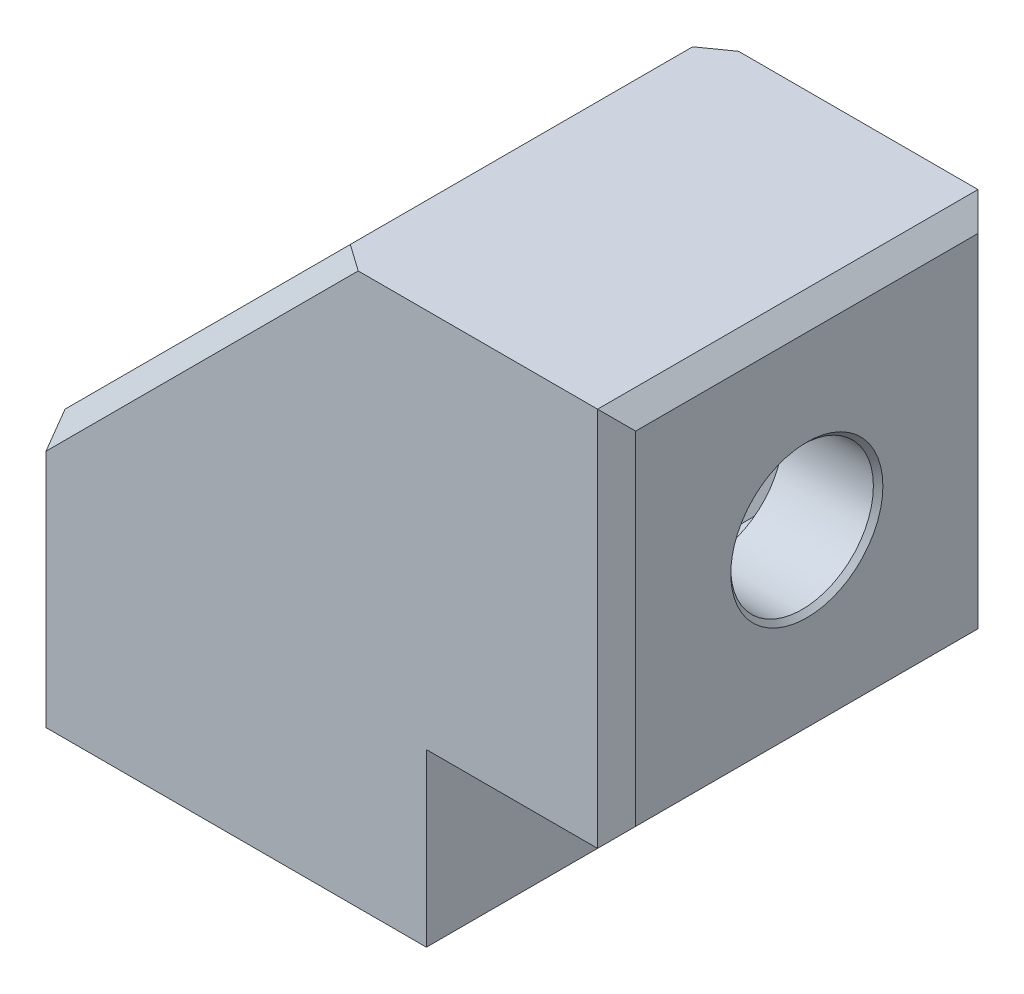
SolidWorks part; units mm, degrees
ref_plane "Front Plane" through (0, 0, 0) normal (0, 0, 1) x (1, 0, 0)
ref_plane "Top Plane" through (0, 0, 0) normal (0, 1, 0) x (1, 0, 0)
ref_plane "Right Plane" through (0, 0, 0) normal (1, 0, 0) x (0, 0, -1)
sketch "Sketch1" plane through (0, 0, 0) normal (0, 0, 1) x (1, 0, 0)
  line L0 (0, 38.1) -> (38.1, 76.2)
  line L1 (0, 0) -> (50.8, 0)
  line L2 (0, 0) -> (0, 38.1)
  line L3 (38.1, 76.2) -> (76.2, 76.2)
  line L4 (76.2, 25.4) -> (76.2, 76.2)
  line L8 (76.2, 25.4) -> (50.8, 25.4)
  line L9 (50.8, 0) -> (50.8, 25.4)
  point P3 (25.4, 0)
  dimension "D1" = 76.2
  dimension "D2" = 25.4
  dimension "D3" = 38.1
  dimension "D4" = 38.1
  dimension "D5" = 25.4
  dimension "D6" = 25.4
extrude "Boss-Extrude1" add sketch "Sketch1" along normal blind 50.8
shell "Shell1" thickness 2.54
sketch "Sketch2" plane through (0, 0, 0) normal (0, -1, 0) x (1, 0, 0)
  line L0 (0, 50.8) -> (0, 0) construction
  line L2 (0, 50.8) -> (50.8, 50.8) construction
  circle A0 centre (25.4, 25.4) radius 9.525
  dimension "D1" = 19.05
  dimension "D2" = 25.4
  dimension "D3" = 25.4
sketch "Sketch3" plane through (76.2, 0, 0) normal (1, 0, 0) x (0, 0, -1)
  line L0 (-50.8, 76.2) -> (0, 76.2) construction
  line L2 (0, 25.4) -> (0, 76.2) construction
  circle A0 centre (-25.4, 50.8) radius 9.525
  dimension "D3" = 19.05
  dimension "D1" = 25.4
  dimension "D2" = 25.4
hole_wizard "3/4 (0.75) Diameter Hole1" positions "Sketch4" profile "Sketch5" hole size "3/4" standard "ANSI Inch"
sketch "Sketch4" plane through (76.2, 0, 0) normal (1, 0, 0) x (0, 0, -1)
  point P0 (-25.4, 50.8)
sketch "Sketch5" plane through (76.2, 50.8, 25.4) normal (0, 1, 0) x (0, 0, -1)
  line L0 (0, 0) -> (0, 12.7)
  line L1 (0, 12.7) -> (9.525, 12.7)
  line L2 (9.525, 12.7) -> (9.525, 0.635)
  line L3 (9.525, 0.635) -> (10.16, 0)
  line L5 (10.16, 0) -> (0, 0)
  line L6 (-9.525, 0.635) -> (-10.16, 0) construction
  line L11 (0, -6.35) -> (0, 107.95) construction
  dimension "Thru Hole Dia." = 19.05
  dimension "Thru Hole Depth" = 12.7
  dimension "Near C'Sink Dia." = 20.32
  dimension "Near C'Sink Angle" = 90
hole_wizard "3/4 (0.75) Diameter Hole2" positions "Sketch6" profile "Sketch7" hole size "3/4" standard "ANSI Inch"
sketch "Sketch6" plane through (0, 0, 0) normal (0, -1, 0) x (-1, 0, 0)
  point P0 (-25.4, -25.4)
sketch "Sketch7" plane through (25.4, 0, 25.4) normal (1, 0, 0) x (0, 0, -1)
  line L0 (0, 0) -> (0, 12.7)
  line L1 (0, 12.7) -> (9.525, 12.7)
  line L2 (9.525, 12.7) -> (9.525, 0.635)
  line L3 (9.525, 0.635) -> (10.16, 0)
  line L5 (10.16, 0) -> (0, 0)
  line L6 (-9.525, 0.635) -> (-10.16, 0) construction
  line L11 (0, -6.35) -> (0, 107.95) construction
  dimension "Thru Hole Dia." = 19.05
  dimension "Thru Hole Depth" = 12.7
  dimension "Near C'Sink Dia." = 20.32
  dimension "Near C'Sink Angle" = 90
sketch "Sketch10" plane through (-19.05, 19.05, 0) normal (-0.7071, 0.7071, 0) x (0, 0, 1)
  line L0 (0, 80.8223) -> (0, 26.9408) construction
  line L1 (50.8, 80.8223) -> (0, 80.8223) construction
  circle A0 centre (25.4, 52.8823) radius 9.525
  circle A1 centre (25.4, 69.3923) radius 2.54
  dimension "D1" = 19.05
  dimension "D4" = 5.08
  dimension "D2" = 25.4
  dimension "D3" = 27.94
  dimension "D5" = 16.51
  dimension "D6" = 25.4
hole_wizard "3/4 (0.75) Diameter Hole3" positions "Sketch11" profile "Sketch12" hole size "3/4" standard "ANSI Inch"
sketch "Sketch11" plane through (-19.05, 19.05, 0) normal (-0.7071, 0.7071, 0) x (0, 0, 1)
  point P0 (25.4, 52.8823)
sketch "Sketch12" plane through (18.3434, 56.4434, 25.4) normal (0, 0, 1) x (-0.7071, -0.7071, 0)
  line L0 (0, 0) -> (0, 2.54)
  line L1 (0, 2.54) -> (9.525, 2.54)
  line L2 (9.525, 2.54) -> (9.525, 0.5328)
  line L3 (9.525, 0.5328) -> (10.16, 0)
  line L5 (10.16, 0) -> (0, 0)
  line L6 (-9.525, 0.5328) -> (-10.16, 0) construction
  line L11 (0, -6.35) -> (0, 107.95) construction
  dimension "Thru Hole Dia." = 19.05
  dimension "Thru Hole Depth" = 2.54
  dimension "Near C'Sink Dia." = 20.32
  dimension "Near C'Sink Angle" = 100
hole_wizard "1/4-20 Tapped Hole1" positions "Sketch13" profile "Sketch15" tap size "1/4-20" standard "ANSI Inch"
sketch "Sketch13" plane through (-19.05, 19.05, 0) normal (-0.7071, 0.7071, 0) x (0, 0, 1)
  point P0 (25.4, 69.3923)
sketch "Sketch15" plane through (30.0178, 68.1178, 25.4) normal (0, 0, 1) x (-0.7071, -0.7071, 0)
  line L0 (0, 0) -> (0, 20.5838)
  line L1 (0, 20.5838) -> (2.5527, 19.05)
  line L2 (2.5527, 19.05) -> (2.5527, 0)
  line L5 (2.5527, 0) -> (0, 0)
  line L10 (0, 20.5838) -> (-2.5527, 19.05) construction
  line L11 (0, -6.35) -> (0, 107.95) construction
  dimension "Tap Drill Dia." = 5.1054
  dimension "Tap Drill Depth" = 19.05
  dimension "Drill Angle" = 118
chamfer "Chamfer1" distance 2.54 angle 45 10 edges at (76.2, 25.4, 25.4) (76.2, 50.8, 50.8) (76.2, 76.2, 25.4) (76.2, 50.8, 0) (19.05, 57.15, 0) (19.05, 57.15, 50.8) (0, 0, 25.4) (25.4, 0, 0) (50.8, 0, 25.4) (25.4, 0, 50.8)
